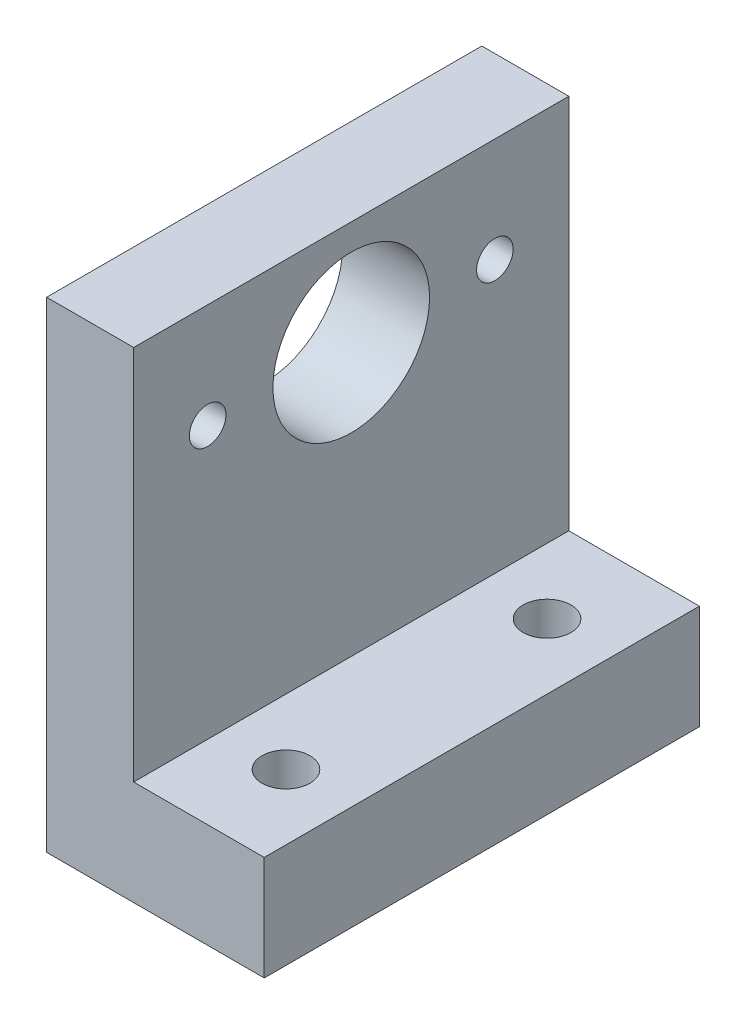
SolidWorks part; units mm, degrees
ref_plane "前视基准面" through (0, 0, 0) normal (0, 0, 1) x (1, 0, 0)
ref_plane "上视基准面" through (0, 0, 0) normal (0, 1, 0) x (1, 0, 0)
ref_plane "右视基准面" through (0, 0, 0) normal (1, 0, 0) x (0, 0, -1)
sketch "草图1" plane through (0, 0, 0) normal (0, 0, 1) x (1, 0, 0)
  line L0 (0, 0) -> (0, 55.24)
  line L1 (10, 12) -> (10, 55.24)
  line L2 (0, 55.24) -> (10, 55.24)
  line L3 (0, 0) -> (25, 0)
  line L4 (25, 0) -> (25, 12)
  line L5 (10, 12) -> (25, 12)
extrude "凸台-拉伸1" add sketch "草图1" along normal blind 50
sketch "草图2" plane through (10, 0, 0) normal (1, 0, 0) x (0, 0, -1)
  line L0 (-50, 0) -> (-50, 55.24)
  line L1 (0, 0) -> (0, 55.24)
  line L2 (-50, 55.24) -> (0, 55.24)
  line L3 (-50, 0) -> (0, 0)
  circle A0 centre (-41.5, 43.24) radius 2.1
  circle A1 centre (-8.5, 43.24) radius 2.1
  circle A2 centre (-25, 43.24) radius 9
extrude "切除-拉伸1" cut sketch "草图2" against normal blind 50 flip side to cut
sketch "草图3" plane through (0, 12, 0) normal (0, 1, 0) x (1, 0, 0)
  circle A0 centre (17.5, -10) radius 2.75
  circle A1 centre (17.5, -40) radius 2.75
extrude "切除-拉伸2" cut sketch "草图3" against normal blind 50
